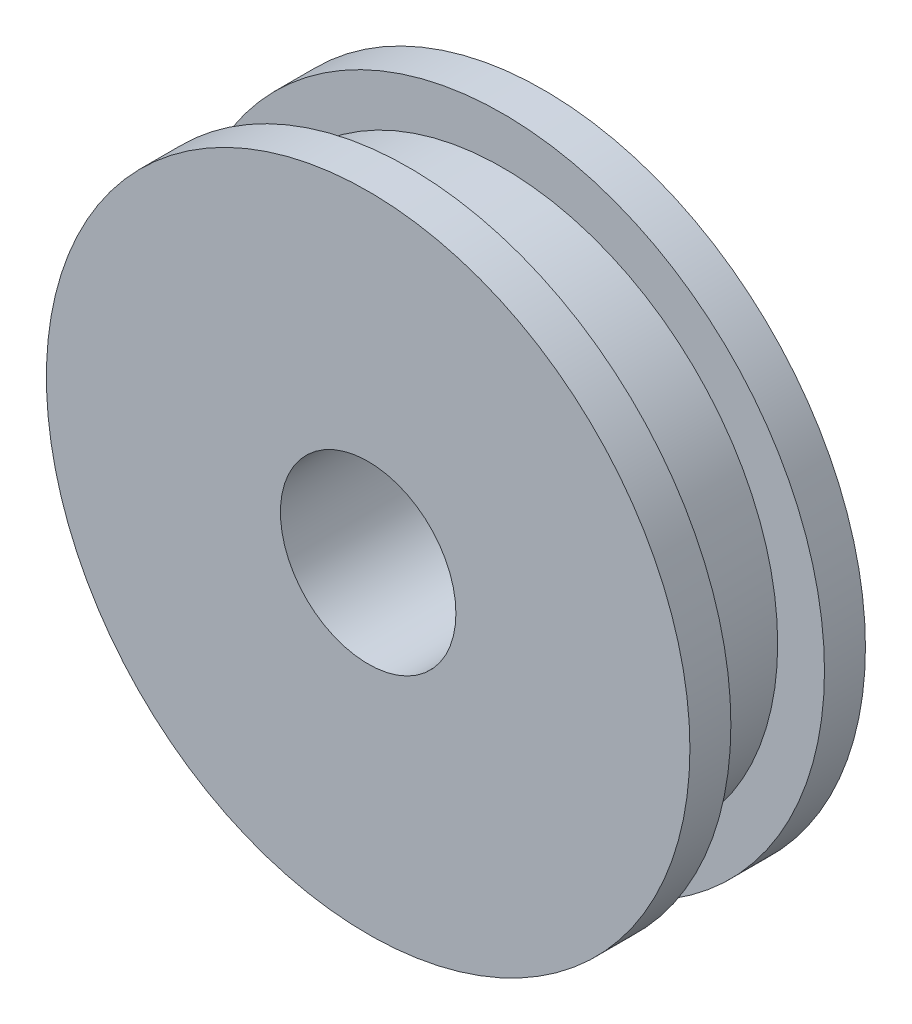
SolidWorks part; units mm, degrees
ref_plane "Plano frontal" through (0, 0, 0) normal (0, 0, 1) x (1, 0, 0)
ref_plane "Plano superior" through (0, 0, 0) normal (0, 1, 0) x (1, 0, 0)
ref_plane "Plano direito" through (0, 0, 0) normal (1, 0, 0) x (0, 0, -1)
sketch "Esboço1" plane through (0, 0, 0) normal (0, 0, 1) x (1, 0, 0)
  circle A0 centre (0, 0) radius 5.5
  dimension "D1" = 11
extrude "Ressalto-extrusão1" add sketch "Esboço1" along normal mid plane 3
sketch "Esboço3" plane through (0, 0, 1.5) normal (0, 0, 1) x (1, 0, 0)
  circle A0 centre (0, 0) radius 1.5
  dimension "D1" = 3
extrude "Corte-extrusão2" cut sketch "Esboço3" against normal through all
sketch "Esboço4" plane through (0, 0, 0) normal (0, 0, 1) x (1, 0, 0)
  point P0 (0, 0)
sketch "Esboço5" plane through (0, 0, 0) normal (0, 1, 0) x (1, 0, 0)
  line L0 (5.5, -0.8) -> (5.5, 0.8)
  line L1 (5.5, -1.5) -> (5.5, 1.5) construction
  line L3 (4.7, -0.8) -> (5.5, -0.8)
  line L4 (0, -1.5) -> (0, 1.5) construction
  line L5 (-5.5, -1.5) -> (5.5, -1.5) construction
  line L6 (5.5, 1.5) -> (-5.5, 1.5) construction
  line L7 (4.7, -0.8) -> (4.7, 0.8)
  line L8 (4.7, 0.8) -> (5.5, 0.8)
  point P5 (5.5, 0)
  dimension "D1" = 1.6
  dimension "D2" = 0.8
revolve "Corte-Revolução1" cut sketch "Esboço5" angle 360 about L4
